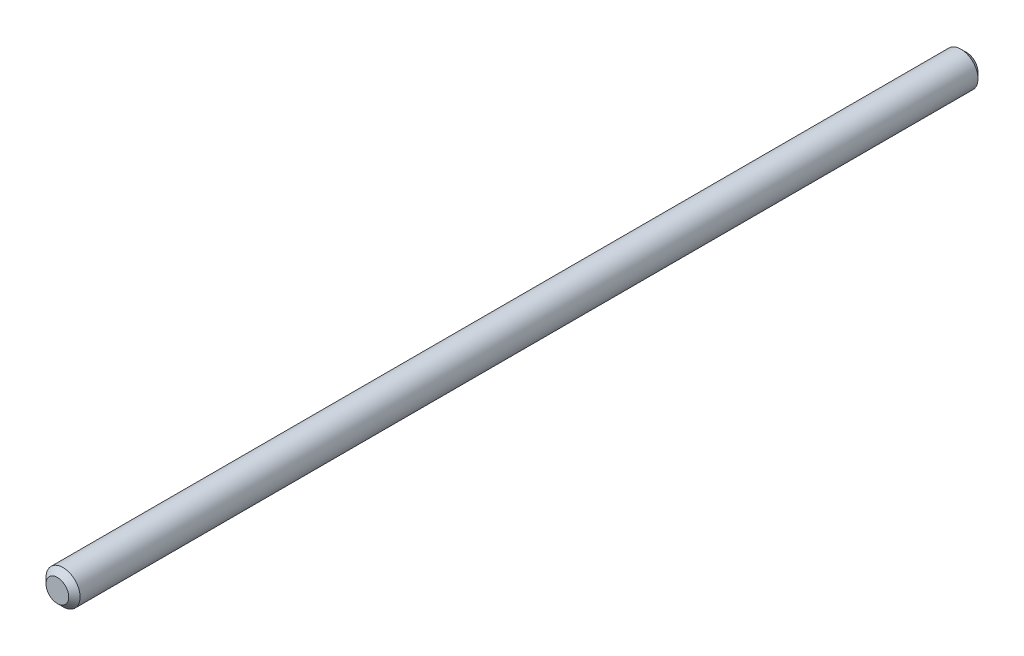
SolidWorks part; units mm, degrees
ref_plane "Face" through (0, 0, 0) normal (0, 0, 1) x (1, 0, 0)
ref_plane "Dessus" through (0, 0, 0) normal (0, 1, 0) x (1, 0, 0)
ref_plane "Droite" through (0, 0, 0) normal (1, 0, 0) x (0, 0, -1)
sketch "Esquisse1" plane through (0, 0, 0) normal (0, 0, 1) x (1, 0, 0)
  circle A0 centre (0, 0) radius 1.5
extrude "Base-Extrusion" add sketch "Esquisse1" along normal blind 80
chamfer "Chanfrein1" distance 0.5 angle 45
